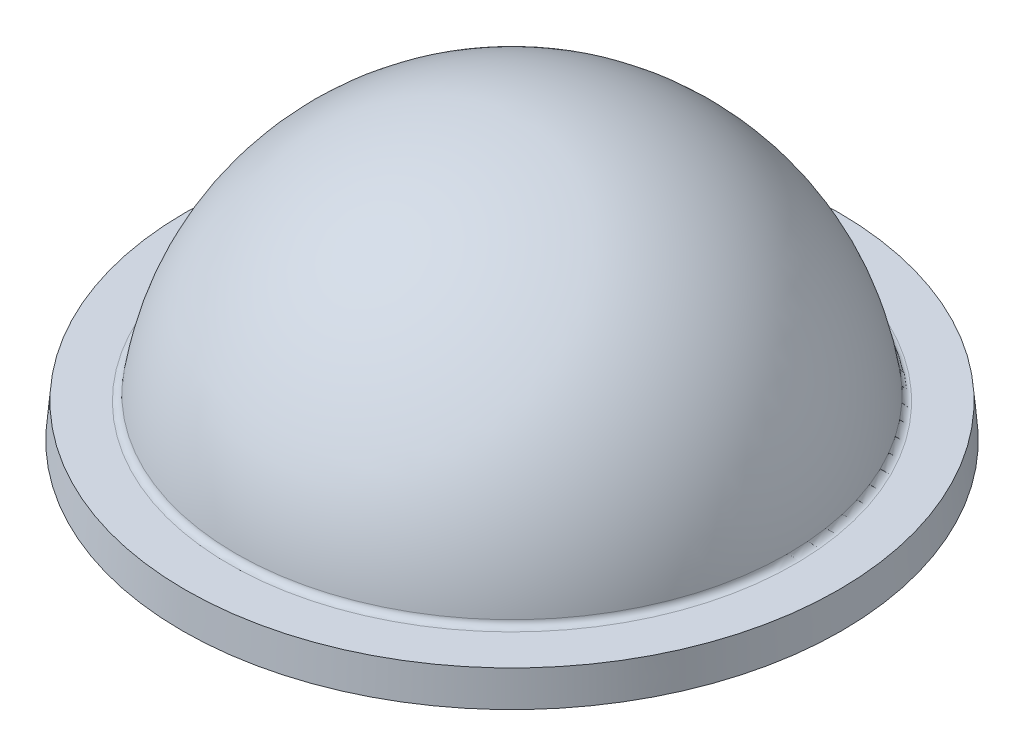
SolidWorks part; units mm, degrees
other "<WTE2-P-DOME-R1>-<Fillet2>"
ref_plane "Front Plane" through (0, 0, 0) normal (0, 0, 1) x (1, 0, 0)
ref_plane "Top Plane" through (0, 0, 0) normal (0, 1, 0) x (1, 0, 0)
ref_plane "Right Plane" through (0, 0, 0) normal (1, 0, 0) x (0, 0, -1)
inserted part "WTE2-P-DOME-R1"
